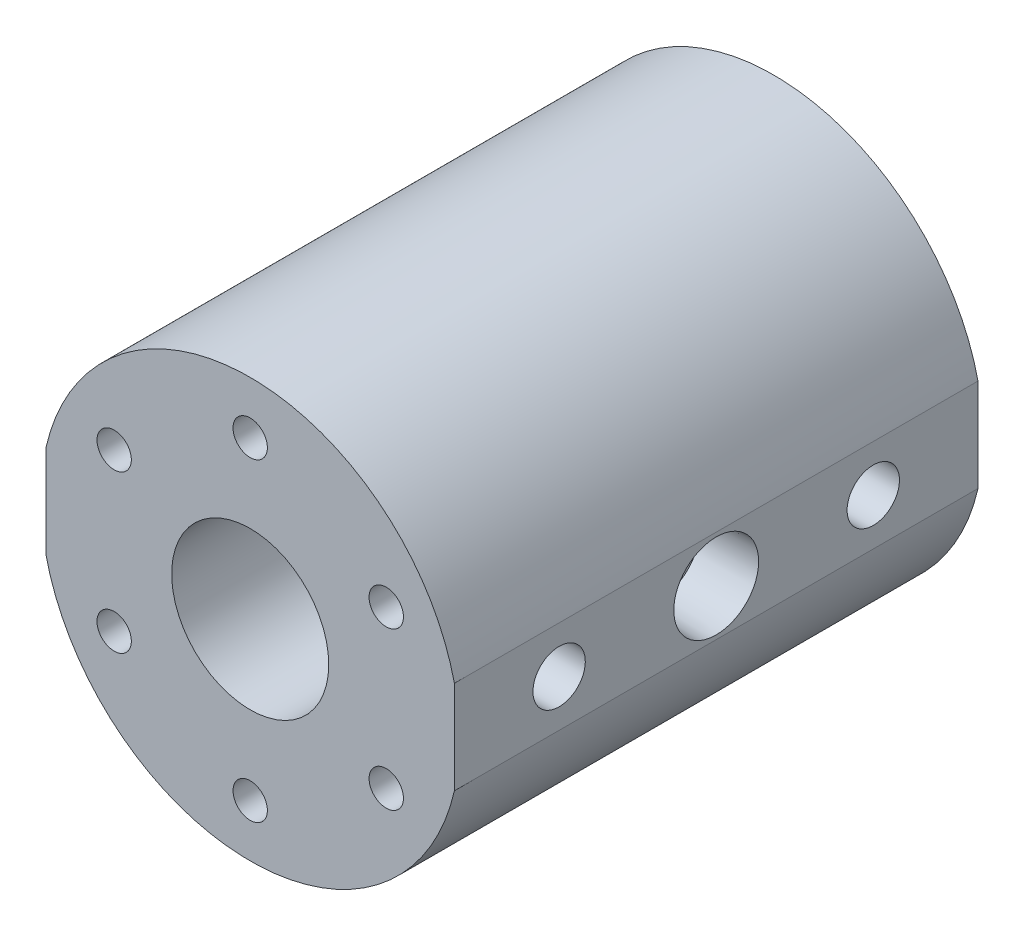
SolidWorks part; units mm, degrees
ref_plane "Front Plane" through (0, 0, 0) normal (0, 0, 1) x (1, 0, 0)
ref_plane "Top Plane" through (0, 0, 0) normal (0, 1, 0) x (1, 0, 0)
ref_plane "Right Plane" through (0, 0, 0) normal (1, 0, 0) x (0, 0, -1)
sketch "Sketch1" plane through (0, 0, 0) normal (0, 0, 1) x (1, 0, 0)
  line L0 (-24.765, 5.644) -> (-24.765, -5.644)
  line L1 (0, 0) -> (-24.765, 0) construction
  line L2 (24.765, 5.644) -> (24.765, -5.644)
  line L3 (0, 0) -> (0, 27.6058) construction
  arc A0 (-24.765, -5.644) -> (24.765, -5.644) centre (0, 0) ccw
  circle A1 centre (0, 0) radius 9.525
  arc A2 (24.765, 5.644) -> (-24.765, 5.644) centre (0, 0) ccw
  dimension "D1" = 19.05
  dimension "D2" = 50.8
  dimension "D3" = 24.765
extrude "Extrude1" add sketch "Sketch1" along normal mid plane 63.5
hole_wizard "#8-32 Tapped Hole1" positions "Sketch3" profile "Sketch2" tap size "#8-32" standard "Ansi Inch"
sketch "Sketch3" plane through (0, 0, 31.75) normal (0, 0, 1) x (1, 0, 0)
  line L0 (0, 0) -> (16.4978, 9.525) construction
  line L2 (0, 0) -> (22.0462, 0) construction
  line L3 (0, 0) -> (0, 19.05) construction
  circle A0 centre (0, 0) radius 19.05 construction
  point P0 (16.4978, 9.525)
  point P32 (0, 19.05)
  point P34 (-16.4978, 9.525)
  point P36 (-16.4978, -9.525)
  point P38 (16.4978, -9.525)
  point P40 (0, -19.05)
  dimension "D1" = 38.1
  dimension "D2" = 30
sketch "Sketch2" plane through (16.4978, 9.525, 31.75) normal (1, 0, 0) x (0, -1, 0)
  line L0 (0, 0) -> (0, 21.2054)
  line L1 (0, 21.2054) -> (1.7272, 20.1676)
  line L2 (1.7272, 20.1676) -> (1.7272, 17.78)
  line L3 (1.7272, 17.78) -> (2.0828, 17.78)
  line L4 (2.0828, 17.78) -> (2.0828, 0)
  line L5 (2.0828, 0) -> (0, 0)
  line L10 (0, 21.2054) -> (-1.7272, 20.1676) construction
  line L11 (0, -6.35) -> (0, 107.95) construction
  dimension "Tap Drill Dia." = 3.4544
  dimension "Tap Drill Depth" = 20.1676
  dimension "Thread Major Dia." = 4.1656
  dimension "Thread Depth" = 17.78
  dimension "Drill Angle" = 118
mirror "Mirror1" about plane through (0, 0, 0) normal (0, 0, 1) of "#8-32 Tapped Hole1"
hole_wizard "Cylinder Holes" positions "Sketch5" profile "Sketch4" size "1/8" standard "Ansi Inch"
sketch "Sketch5" plane through (-24.765, 0, 0) normal (-1, 0, 0) x (0, 0, 1)
  line L0 (0, 0) -> (0, 35.794) construction
  point P0 (12.7, 0)
  point P1 (-12.7, 0)
  dimension "D1" = 25.4
sketch "Sketch4" plane through (-24.765, 0, 12.7) normal (0, 1, 0) x (0, 0, 1)
  line L0 (0, 0) -> (0, 14.1565)
  line L1 (4.2164, 11.623) -> (0, 14.1565)
  line L2 (-4.2164, 11.623) -> (0, 14.1565) construction
  line L3 (4.2164, 11.623) -> (4.2164, 6.924)
  line L4 (4.2164, 6.924) -> (4.9362, 6.924)
  line L5 (4.9362, 6.924) -> (5.1435, 0)
  line L6 (-4.9362, 6.924) -> (-5.1435, 0) construction
  line L7 (5.1435, 0) -> (0, 0)
  line L8 (0, -6.35) -> (0, 107.95) construction
  line L11 (-4.2164, 6.924) -> (-4.9362, 6.924) construction
  dimension "Tap Drill Dia." = 8.4328
  dimension "Tap Drill Depth" = 11.623
  dimension "Thread Dia." = 10.287
  dimension "Thread Angle" = 3.43
  dimension "Thread Depth" = 6.924
  dimension "Drill Angle" = 118
hole_wizard "Steam Hole" positions "Sketch8" profile "Sketch7" size "1/8" standard "Ansi Inch"
sketch "Sketch8" plane through (24.765, 0, 0) normal (1, 0, 0) x (0, 0, -1)
  point P0 (0, 0)
sketch "Sketch7" plane through (24.765, 0, 0) normal (0, 1, 0) x (0, 0, -1)
  line L0 (0, 0) -> (0, 10.7885)
  line L1 (4.2164, 8.255) -> (0, 10.7885)
  line L2 (-4.2164, 8.255) -> (0, 10.7885) construction
  line L3 (4.2164, 8.255) -> (4.2164, 6.924)
  line L4 (4.2164, 6.924) -> (4.9362, 6.924)
  line L5 (4.9362, 6.924) -> (5.1435, 0)
  line L6 (-4.9362, 6.924) -> (-5.1435, 0) construction
  line L7 (5.1435, 0) -> (0, 0)
  line L8 (0, -6.35) -> (0, 107.95) construction
  line L11 (-4.2164, 6.924) -> (-4.9362, 6.924) construction
  dimension "Tap Drill Dia." = 8.4328
  dimension "Tap Drill Depth" = 8.255
  dimension "Thread Dia." = 10.287
  dimension "Thread Angle" = 3.43
  dimension "Thread Depth" = 6.924
  dimension "Drill Angle" = 118
sketch "Sketch12" plane through (24.765, 0, 0) normal (1, 0, 0) x (0, 0, -1)
  line L0 (0, 0) -> (0, -34.9336) construction
  circle A0 centre (-19.05, 0) radius 3.175
  circle A1 centre (19.05, 0) radius 3.175
  circle A2 centre (0, 0) radius 3.175
  dimension "D1" = 6.35
  dimension "D2" = 38.1
extrude "Cut-Extrude1" cut sketch "Sketch12" against normal up to next
sketch "Sketch13" plane through (-24.765, 0, 0) normal (-1, 0, 0) x (0, 0, 1)
  circle A0 centre (12.7, 0) radius 3.175
  circle A1 centre (-12.7, 0) radius 3.175
  circle A2 centre (-12.7, 0) radius 5.1435 construction
  circle A3 centre (12.7, 0) radius 5.1435 construction
  dimension "D1" = 6.35
extrude "Cut-Extrude2" cut sketch "Sketch13" against normal up to next
